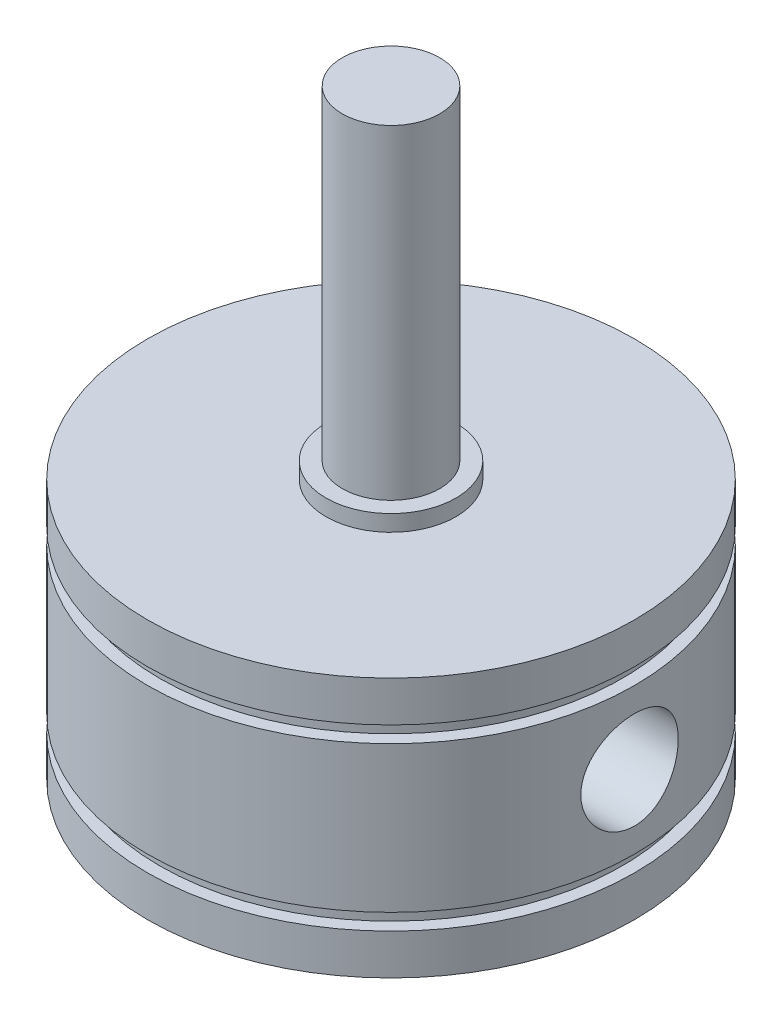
SolidWorks part; units mm, degrees
ref_plane "Plano frontal" through (0, 0, 0) normal (0, 0, 1) x (1, 0, 0)
ref_plane "Plano superior" through (0, 0, 0) normal (0, 1, 0) x (1, 0, 0)
ref_plane "Plano direito" through (0, 0, 0) normal (1, 0, 0) x (0, 0, -1)
sketch "Esboço2" plane through (0, 0, 0) normal (0, 0, 1) x (1, 0, 0)
  line L0 (0, 0) -> (0, 41)
  line L1 (0, 41) -> (3, 41)
  line L2 (3, 41) -> (3, 21)
  line L3 (3, 21) -> (4, 21)
  line L4 (4, 21) -> (4, 20)
  line L5 (4, 20) -> (15, 20)
  line L6 (15, 20) -> (15, 17.5)
  line L7 (15, 17.5) -> (14.25, 17.5)
  line L8 (14.25, 17.5) -> (14.25, 16.5)
  line L9 (14.25, 16.5) -> (15, 16.5)
  line L10 (15, 16.5) -> (15, 7.5)
  line L11 (15, 7.5) -> (14.25, 7.5)
  line L12 (14.25, 7.5) -> (14.25, 6.5)
  line L13 (14.25, 6.5) -> (15, 6.5)
  line L14 (15, 6.5) -> (15, 4)
  line L15 (15, 4) -> (4, 4)
  line L16 (4, 4) -> (4, 3)
  line L17 (4, 3) -> (3, 3)
  line L18 (3, 3) -> (3, 0)
  line L19 (3, 0) -> (0, 0)
  line L20 (0, 52.8834) -> (0, -8.8878) construction
  dimension "D1" = 41
  dimension "D2" = 16
  dimension "D3" = 3
  dimension "D4" = 1
  dimension "D5" = 1
  dimension "D6" = 20
  dimension "D7" = 3
  dimension "D8" = 3
  dimension "D9" = 11
  dimension "D10" = 2.5
  dimension "D11" = 0.75
  dimension "D12" = 1
  dimension "D13" = 4
revolve "Revolução" add sketch "Esboço2" angle 360 about L20
ref_plane "Plano1" through (-15, 0, 0) normal (-1, 0, 0) x (0, 0, 1)
sketch "Esboço4" plane through (-15, 0, 0) normal (-1, 0, 0) x (0, 0, 1)
  circle A0 centre (0, 12) radius 3
  dimension "D1" = 6
extrude "Furo perpendicular" cut sketch "Esboço4" against normal through all
ref_plane "Plano2" through (-13.5946, 0, 6.3393) normal (-0.9063, 0, 0.4226) x (0, 1, 0)
sketch "Esboço5" plane through (-13.5946, 0, 6.3393) normal (-0.9063, 0, 0.4226) x (0, 1, 0)
  circle A0 centre (12, 0) radius 3
  dimension "D1" = 6
ref_plane "Plano3" through (0, 12, 0) normal (0, 1, 0) x (1, 0, 0)
sketch "Esboço7" plane through (0, 12, 0) normal (0, 1, 0) x (1, 0, 0)
  line L0 (-13.5946, -6.3393) -> (0, 0)
sweep "Furo desviado a 25 graus" cut profiles "Esboço5" path "Esboço7"
